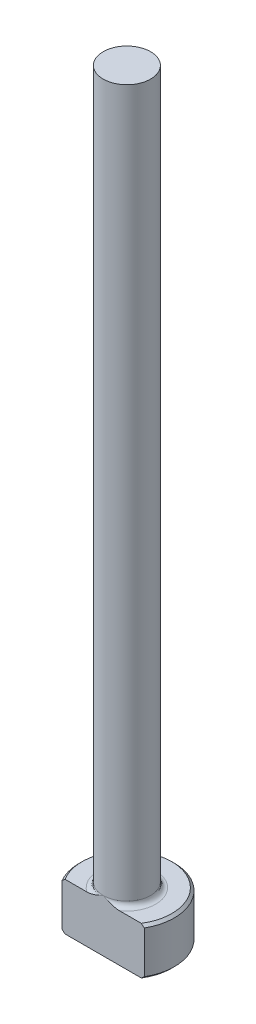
SolidWorks part; units mm, degrees
ref_plane "Front Plane" through (0, 0, 0) normal (0, 0, 1) x (1, 0, 0)
ref_plane "Top Plane" through (0, 0, 0) normal (0, 1, 0) x (1, 0, 0)
ref_plane "Right Plane" through (0, 0, 0) normal (1, 0, 0) x (0, 0, -1)
sketch "Sketch1" plane through (0, 0, 0) normal (0, 0, 1) x (1, 0, 0)
  line L0 (0, 259.9588) -> (0, -15.1925) construction
  line L1 (0, 0) -> (-4.7625, 0)
  line L2 (-4.7625, 0) -> (-4.7625, 4.7498)
  line L3 (-4.7625, 4.7498) -> (-2.3812, 4.7498)
  line L4 (-2.3812, 4.7498) -> (-2.3812, 76.2)
  line L5 (-2.3812, 76.2) -> (0, 76.2)
  line L6 (0, 76.2) -> (0, 0)
  dimension "L" = 76.2
  dimension "H" = 9.525
  dimension "T" = 4.7498
  dimension "D" = 4.7625
revolve "Revolve1" add sketch "Sketch1" angle 360 about L0
chamfer "Chamfer1" distance 0.254 angle 45 2 edges at (0, 4.7498, 4.7625) (0, 0, 4.7625)
fillet "Fillet1" radius 0.508 1 edges at (0, 4.7498, 2.3812)
sketch "Sketch2" plane through (0, 0, 0) normal (0, 1, 0) x (1, 0, 0)
  line L0 (-4.1244, -2.3812) -> (4.1244, -2.3812)
  circle A0 centre (0, 0) radius 4.7625 construction
  arc A1 (-4.1244, -2.3812) -> (4.1244, -2.3812) centre (0, 0) ccw
  circle A3 centre (0, 0) radius 2.3812 construction
  dimension "D1" = 0
extrude "Key" cut sketch "Sketch2" along normal through all
sketch "Pocket Sketch" plane through (0, 0, 0) normal (0, 0, 1) x (1, 0, 0)
  line L0 (-5.1594, 0) -> (-5.1594, 4.7752)
  line L1 (-5.1594, 4.7752) -> (-3.3417, 4.7752)
  line L2 (-2.5797, 5.5372) -> (-2.5797, 22.225)
  line L3 (-2.5797, 22.225) -> (0, 22.225)
  line L4 (0, 22.225) -> (0, 0)
  line L5 (0, 0) -> (-5.1594, 0)
  line L6 (0, 12.6104) -> (0, -2.4989) construction
  line L7 (-4.7625, 4.4958) -> (-4.7625, 0.254) construction
  line L8 (4.5085, 4.7498) -> (-4.5085, 4.7498) construction
  line L9 (-2.3812, 76.2) -> (-2.3812, 5.2578) construction
  line L10 (-3.3417, 4.7752) -> (-2.5797, 5.5372)
  point P3 (-2.5797, 4.7752)
  dimension "D1" = 10.3187
  dimension "D2" = 0.3969
  dimension "D3" = 0.0254
  dimension "D4" = 0.1984
  dimension "D5" = 5.1594
  dimension "D6" = 22.225
